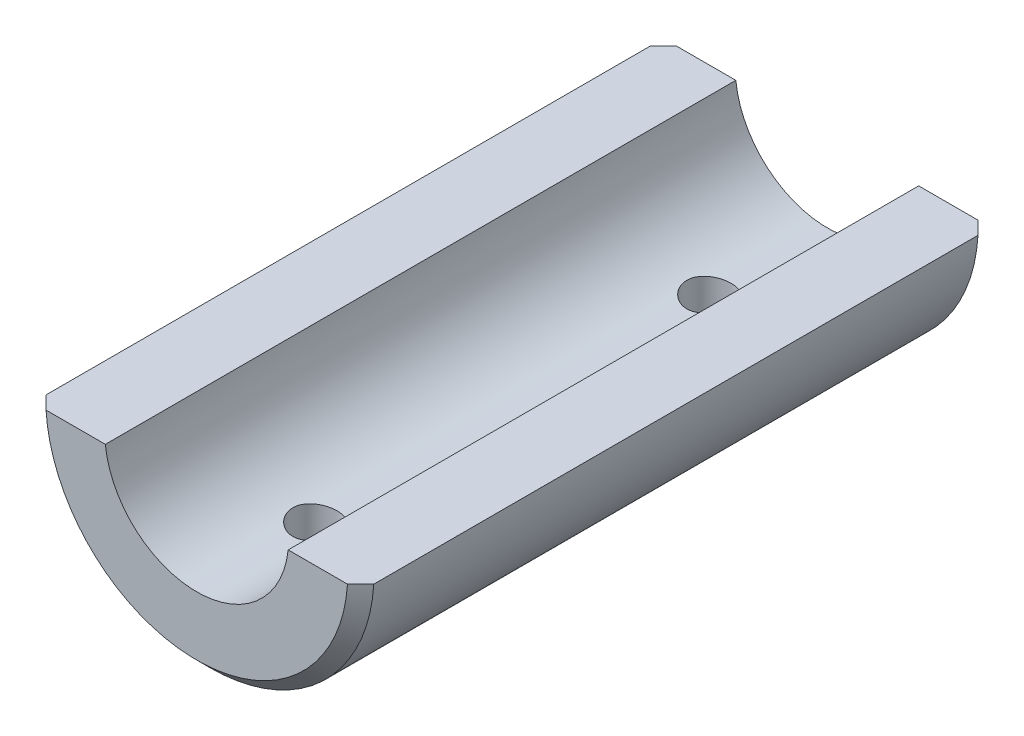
SolidWorks part; units mm, degrees
ref_plane "Plan1" through (0, 0, 0) normal (0, 0, 1) x (1, 0, 0)
ref_plane "Plan2" through (0, 0, 0) normal (0, 1, 0) x (1, 0, 0)
ref_plane "Plan3" through (0, 0, 0) normal (1, 0, 0) x (0, 0, -1)
sketch "Esquisse1" plane through (0, 0, 0) normal (0, 0, 1) x (1, 0, 0)
  line L0 (-24.955, -1.5) -> (-13.9194, -1.5)
  line L1 (13.9194, -1.5) -> (24.955, -1.5)
  arc A0 (-13.9194, -1.5) -> (13.9194, -1.5) centre (0, 0) ccw
  arc A1 (-24.955, -1.5) -> (24.955, -1.5) centre (0, 0) ccw
  dimension "D1" = 28
  dimension "D2" = 50
  dimension "D3" = 1.5
extrude "Extrusion1" add sketch "Esquisse1" along normal blind 96
sketch "Esquisse5" plane through (0, -1.5, 0) normal (0, 1, 0) x (-1, 0, 0)
  line L0 (-13.9194, 0) -> (13.9194, 0) construction
  line L1 (-24.955, 96) -> (-13.9194, 96) construction
  circle A0 centre (0, 78) radius 3.375
  circle A1 centre (0, 18) radius 3.375
  dimension "D1" = 6.75
  dimension "D2" = 6.75
  dimension "D3" = 18
  dimension "D4" = 18
extrude "Enlèv. mat.-Extru.1" cut sketch "Esquisse5" against normal through all
chamfer "Chanfrein1" distance 2 angle 45
